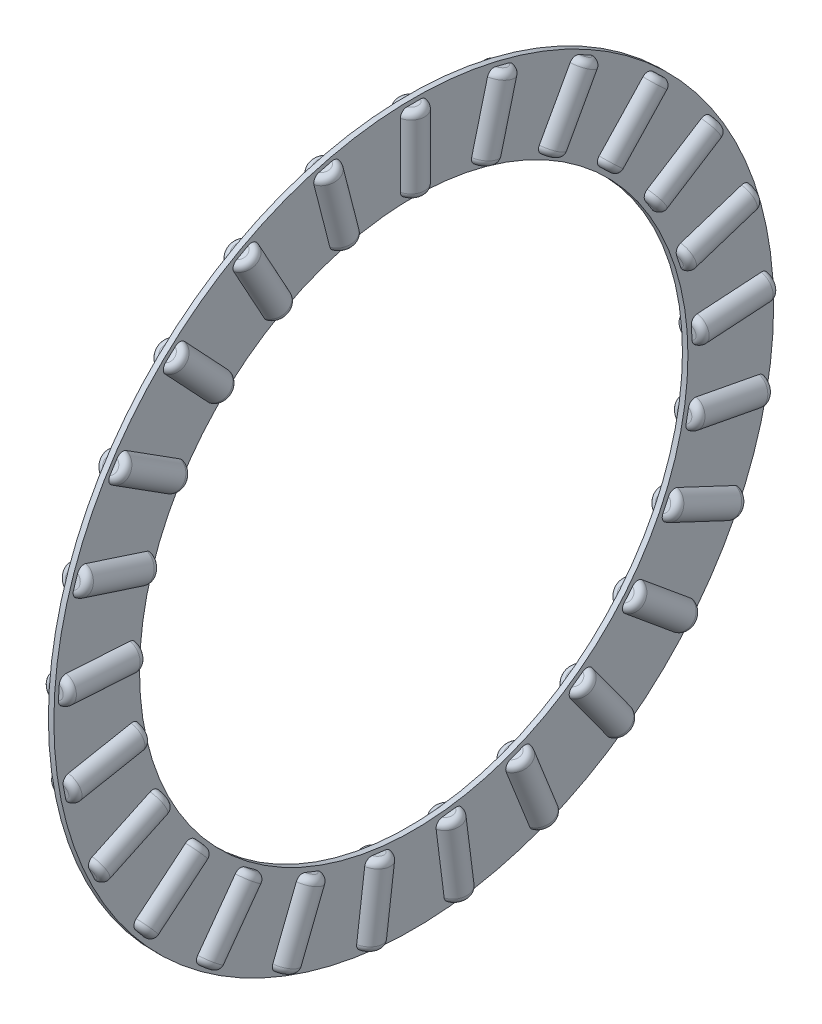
SolidWorks part; units mm, degrees
ref_plane "Plane1" through (0, 0, 0) normal (0, 0, 1) x (1, 0, 0)
ref_plane "Plane2" through (0, 0, 0) normal (0, 1, 0) x (1, 0, 0)
ref_plane "Plane3" through (0, 0, 0) normal (1, 0, 0) x (0, 0, -1)
sketch "Clipboard" plane through (0, 0, 0) normal (0, 0, 1) x (1, 0, 0)
  line L0 (-10, 0) -> (10, 0) construction
  line L1 (0, 0) -> (20.2657, -9.45)
  line L2 (0, 0) -> (41.9167, 19.5461)
  line L3 (0, 0) -> (20.2657, -9.45)
  line L4 (0, 0) -> (-22.3471, -0.7804)
  dimension "BallCLRad" = 46.25
  dimension "Count" = 25
  dimension "Show_count" = 25
  dimension "Max_count" = 25
  dimension "Min_count" = 2
sketch "CagSpiSke" plane through (0, 0, 0) normal (0, 0, 1) x (1, 0, 0)
  line L5 (-34.925, 0) -> (34.925, 0) construction
  line L6 (-0.4, 52.5) -> (0.4, 52.5)
  line L7 (-0.4, 52.5) -> (-0.4, 40)
  line L8 (-0.4, 40) -> (0.4, 40)
  line L9 (0.4, 52.5) -> (0.4, 40)
  dimension "ID" = 80
  dimension "OD" = 105
  dimension "Thickness" = 0.8
  dimension "HalfThick" = 0.4
revolve "CageSpine" add sketch "CagSpiSke" angle 360 about L5
ref_axis "Axis1" through (-50, 0, 0) along (1, 0, 0)
sketch "RolDetSke" plane through (0, 0, 0) normal (0, 0, 1) x (1, 0, 0)
  line L0 (0, 33.02) -> (0, 55.88) construction
  line L3 (0, 51.875) -> (1.04, 51.875)
  line L4 (0, 51.875) -> (0, 40.625)
  line L5 (0, 40.625) -> (1.04, 40.625)
  line L6 (2, 50.915) -> (2, 41.585)
  arc A0 (2, 41.585) -> (1.04, 40.625) centre (1.04, 41.585) cw
  arc A1 (1.04, 51.875) -> (2, 50.915) centre (1.04, 50.915) cw
  dimension "radius" = 0.96
  dimension "Roller_diameter" = 4
  dimension "Cyl_Len" = 11.25
  dimension "offset" = 40.625
revolve "RollerDetailed" add sketch "RolDetSke" angle 360 about L0
pattern_circular "RollersDetailed" count 25 every 14.4 about axis through (-50, 0, 0) along (1, 0, 0) of "RollerDetailed"
sketch "RolSimSke" plane through (0, 0, 0) normal (0, 0, 1) x (1, 0, 0)
  line L1 (-17.78, 0) -> (12.7, 0) construction
  line L3 (-1.04, 51.875) -> (1.04, 51.875)
  line L4 (-2, 50.915) -> (-2, 41.585)
  line L5 (-1.04, 40.625) -> (1.04, 40.625)
  line L6 (2, 50.915) -> (2, 41.585)
  arc A0 (-2, 41.585) -> (-1.04, 40.625) centre (-1.04, 41.585) ccw
  arc A1 (-1.04, 51.875) -> (-2, 50.915) centre (-1.04, 50.915) ccw
  arc A2 (2, 50.915) -> (1.04, 51.875) centre (1.04, 50.915) ccw
  arc A3 (1.04, 40.625) -> (2, 41.585) centre (1.04, 41.585) ccw
  dimension "Rol_rad" = 0.96
  dimension "Roller_diameter" = 4
  dimension "Cyl_Len" = 11.25
  dimension "offset" = 40.625
  dimension "Halfdia" = 2
revolve "RollersSimplified" [suppressed] add sketch "RolSimSke" angle 360 about L1
equation "\"BallCLRad@Clipboard\" =  ( \"OD@CagSpiSke\" + \"ID@CagSpiSke\" )  / 4"
equation "\"offset@RolSimSke\" = \"BallCLRad@Clipboard\" - \"Cyl_Len@RolSimSke\" / 2"
equation "\"offset@RolDetSke\" = \"BallCLRad@Clipboard\" - \"Cyl_Len@RolDetSke\" / 2"
equation "\"Thickness@CagSpiSke\" =  \"Roller_diameter@RolDetSke\" * 0.2"
equation "\"HalfThick@CagSpiSke\" = \"Thickness@CagSpiSke\" / 2"
equation "\"radius@RolDetSke\" =  ( \"Roller_diameter@RolDetSke\" - \"Thickness@CagSpiSke\" )  * 0.6 / 2"
equation "\"Roller_diameter@RolSimSke\" = \"Roller_diameter@RolDetSke\""
equation "\"Cyl_Len@RolSimSke\" = \"Cyl_Len@RolDetSke\""
equation "\"Rol_rad@RolSimSke\" = \"radius@RolDetSke\""
equation "\"Halfdia@RolSimSke\" = \"Roller_diameter@RolSimSke\" / 2"
equation "\"Max_count@Clipboard\" = int( 3.14159265 / atn(( \"Roller_diameter@RolDetSke\" / 2) / sqr( \"offset@RolDetSke\"  *  \"offset@RolDetSke\" - ( \"Roller_diameter@RolDetSke\" / 2) *  ( \"Roller_diameter@RolDetSke\" "
equation "\"Max_count@Clipboard\" = ((sgn( \"Max_count@Clipboard\" - \"Count@Clipboard\" )-1)*( \"Max_count@Clipboard\" - \"Count@Clipboard\" ))/-2+ \"Count@Clipboard\""
equation "\"Count@RollersDetailed\" = int( \"Show_count@Clipboard\" ) "
equation "\"Count@RollersDetailed\" = ((sgn( \"Count@RollersDetailed\" - \"Max_count@Clipboard\" )-1)*( \"Count@RollersDetailed\" - \"Max_count@Clipboard\" ))/-2+ \"Max_count@Clipboard\""
equation "\"Count@RollersDetailed\" = ((sgn( \"Count@RollersDetailed\" - \"Min_count@Clipboard\" )+1)*( \"Count@RollersDetailed\" - \"Min_count@Clipboard\"))/2 +\"Min_count@Clipboard\""
equation "\"Angle@RollersDetailed\" = 360.0 / \"Max_count@Clipboard\""
